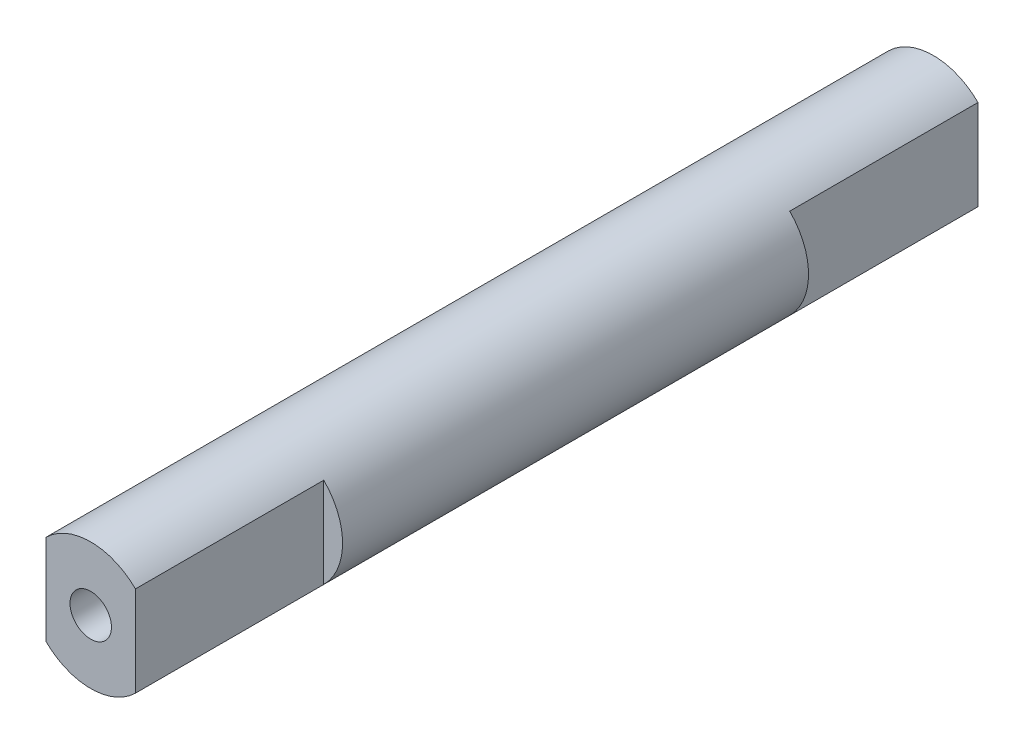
SolidWorks part; units mm, degrees
ref_plane "Front" through (0, 0, 0) normal (0, 0, 1) x (1, 0, 0)
ref_plane "Top" through (0, 0, 0) normal (0, 1, 0) x (1, 0, 0)
ref_plane "Right" through (0, 0, 0) normal (1, 0, 0) x (0, 0, -1)
sketch "Sketch1" plane through (0, 0, 0) normal (0, 0, 1) x (1, 0, 0)
  circle A0 centre (0, 0) radius 2.7
  dimension "D1" = 5.4
extrude "Extrude1" add sketch "Sketch1" along normal blind 0.5
sketch "Sketch2" plane through (0, 0, 0.5) normal (0, 0, 1) x (1, 0, 0)
  line L0 (0, -3.667) -> (0, 3.8813) construction
  line L1 (1.9, -1.9183) -> (1.9, 1.9183)
  line L2 (-1.9, -1.9183) -> (-1.9, 1.9183)
  circle A0 centre (0, 0) radius 2.7 construction
  arc A1 (1.9, 1.9183) -> (-1.9, 1.9183) centre (0, 0) ccw
  arc A2 (-1.9, -1.9183) -> (1.9, -1.9183) centre (0, 0) ccw
  dimension "D1" = 3.8
extrude "Extrude2" add sketch "Sketch2" along normal blind 8
sketch "Skica1" plane through (0, 0, 0) normal (0, 0, -1) x (-1, 0, 0)
  circle A0 centre (0, 0) radius 2.7 construction
  circle A1 centre (0, 0) radius 2.7
extrude "Přidat vysunutím1" add sketch "Skica1" along normal blind 18.796
ref_plane "Rovina1" through (0, 0, -9.398) normal (0, 0, 1) x (1, 0, 0)
mirror "Zrcadlit4" about plane through (0, 0, -9.398) normal (0, 0, 1) of "Extrude2", "Extrude1"
sketch "Sketch3" plane through (0, 0, 8.5) normal (0, 0, 1) x (1, 0, 0)
  circle A0 centre (0, 0) radius 0.88
extrude "Cut-Extrude1" cut sketch "Sketch3" against normal through all
